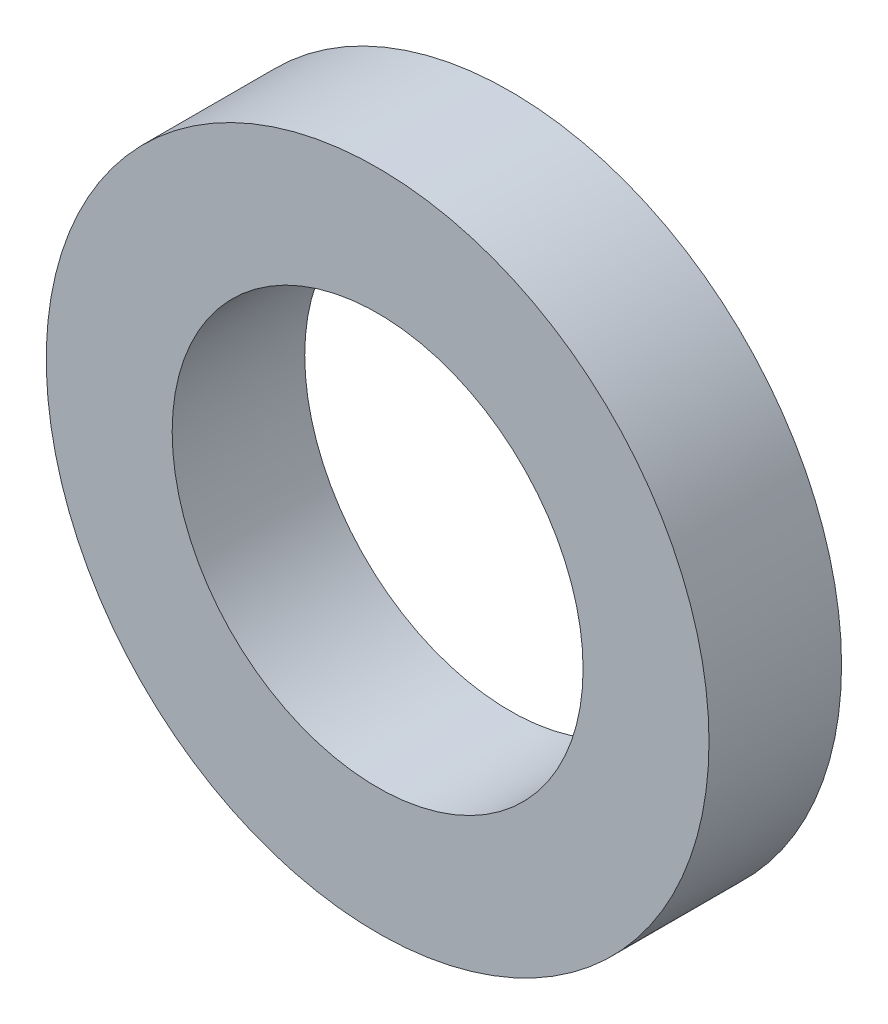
SolidWorks part; units mm, degrees
ref_plane "Alzado" through (0, 0, 0) normal (0, 0, 1) x (1, 0, 0)
ref_plane "Planta" through (0, 0, 0) normal (0, 1, 0) x (1, 0, 0)
ref_plane "Vista lateral" through (0, 0, 0) normal (1, 0, 0) x (0, 0, -1)
sketch "Croquis1" plane through (0, 0, 0) normal (0, 0, 1) x (1, 0, 0)
  circle A0 centre (0, 0) radius 12.5
  circle A1 centre (0, 0) radius 7.75
  dimension "D1" = 25
  dimension "D2" = 15.5
extrude "Saliente-Extruir1" add sketch "Croquis1" along normal blind 5
